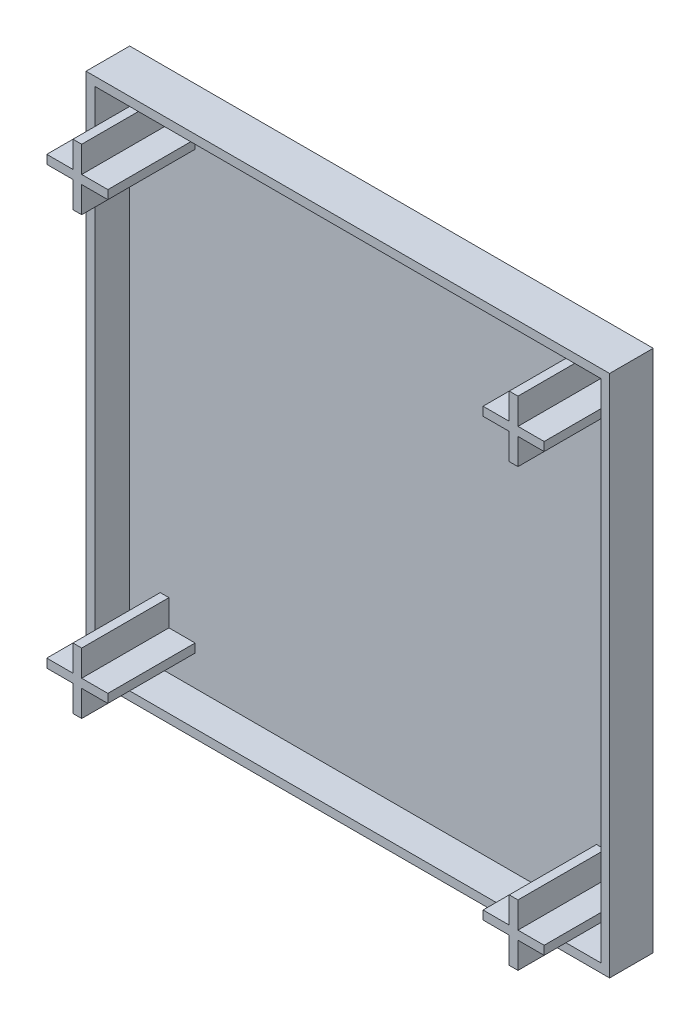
SolidWorks part; units mm, degrees
ref_plane "前视基准面" through (0, 0, 0) normal (0, 0, 1) x (1, 0, 0)
ref_plane "上视基准面" through (0, 0, 0) normal (0, 1, 0) x (1, 0, 0)
ref_plane "右视基准面" through (0, 0, 0) normal (1, 0, 0) x (0, 0, -1)
sketch "草图1" plane through (0, 0, 0) normal (0, 0, 1) x (1, 0, 0)
  line L1 (-30, 30) -> (30, 30)
  line L2 (-30, 30) -> (-30, -30)
  line L3 (-30, -30) -> (30, -30)
  line L4 (30, 30) -> (30, -30)
  dimension "D1" = 60
  dimension "D2" = 60
  dimension "D3" = 30
extrude "凸台-拉伸1" add sketch "草图1" along normal mid plane 5
shell "抽壳1" thickness 1
sketch "草图2" plane through (0, 0, -1.5) normal (0, 0, 1) x (1, 0, 0)
  line L0 (-25, 28.5) -> (-25, 25.5) construction
  line L1 (-28.5, 25.5) -> (-25.5, 25.5)
  line L2 (-28.5, 25.5) -> (-28.5, 24.5)
  line L3 (-28.5, 24.5) -> (-25.5, 24.5)
  line L4 (-21.5, 25.5) -> (-21.5, 24.5)
  line L5 (-25.5, 28.5) -> (-24.5, 28.5)
  line L6 (-25.5, 28.5) -> (-25.5, 25.5)
  line L7 (-25.5, 21.5) -> (-24.5, 21.5)
  line L8 (-24.5, 28.5) -> (-24.5, 25.5)
  line L9 (-25, 21.5) -> (-28.5, 25) construction
  line L10 (24.5, 25.5) -> (21.5, 25.5)
  line L12 (-30, 30) -> (-30, -30) construction
  line L13 (0, 29) -> (0, -29) construction
  line L14 (29, 29) -> (-29, 29) construction
  line L15 (-29, -29) -> (29, -29) construction
  line L16 (28.5, 25) -> (21.5, 25) construction
  line L17 (25, 21.5) -> (28.5, 25) construction
  line L18 (25, 28.5) -> (25, 21.5) construction
  line L19 (24.5, 28.5) -> (24.5, 25.5)
  line L20 (25.5, 21.5) -> (24.5, 21.5)
  line L21 (25.5, 28.5) -> (25.5, 25.5)
  line L22 (25.5, 28.5) -> (24.5, 28.5)
  line L23 (21.5, 25.5) -> (21.5, 24.5)
  line L24 (28.5, 24.5) -> (25.5, 24.5)
  line L25 (28.5, 25.5) -> (28.5, 24.5)
  line L26 (28.5, 25.5) -> (25.5, 25.5)
  line L27 (-29, 0) -> (29, 0) construction
  line L28 (-29, 29) -> (-29, -29) construction
  line L29 (29, -29) -> (29, 29) construction
  line L30 (25, -28.5) -> (25, -21.5) construction
  line L31 (25, -21.5) -> (28.5, -25) construction
  line L32 (28.5, -25) -> (21.5, -25) construction
  line L33 (-28.5, -25) -> (-25.5, -25) construction
  line L34 (-25, -21.5) -> (-28.5, -25) construction
  line L35 (-25, -28.5) -> (-25, -25.5) construction
  line L36 (28.5, -25.5) -> (25.5, -25.5)
  line L37 (28.5, -25.5) -> (28.5, -24.5)
  line L38 (28.5, -24.5) -> (25.5, -24.5)
  line L39 (21.5, -25.5) -> (21.5, -24.5)
  line L40 (25.5, -28.5) -> (24.5, -28.5)
  line L41 (25.5, -28.5) -> (25.5, -25.5)
  line L42 (25.5, -21.5) -> (24.5, -21.5)
  line L43 (24.5, -28.5) -> (24.5, -25.5)
  line L44 (-24.5, -28.5) -> (-24.5, -25.5)
  line L45 (-25.5, -21.5) -> (-24.5, -21.5)
  line L46 (-25.5, -28.5) -> (-25.5, -25.5)
  line L47 (-25.5, -28.5) -> (-24.5, -28.5)
  line L48 (-21.5, -25.5) -> (-21.5, -24.5)
  line L49 (-28.5, -24.5) -> (-25.5, -24.5)
  line L50 (-28.5, -25.5) -> (-28.5, -24.5)
  line L51 (-28.5, -25.5) -> (-25.5, -25.5)
  line L52 (-24.5, 25.5) -> (-21.5, 25.5)
  line L53 (-25.5, 24.5) -> (-25.5, 21.5)
  line L54 (-24.5, 24.5) -> (-21.5, 24.5)
  line L55 (-24.5, 24.5) -> (-24.5, 21.5)
  line L56 (24.5, 24.5) -> (24.5, 21.5)
  line L57 (24.5, 24.5) -> (21.5, 24.5)
  line L58 (25.5, 24.5) -> (25.5, 21.5)
  line L59 (-24.5, -24.5) -> (-21.5, -24.5)
  line L60 (-25.5, -24.5) -> (-25.5, -21.5)
  line L61 (-25, -25) -> (-21.5, -25) construction
  line L62 (-24.5, -25.5) -> (-21.5, -25.5)
  line L63 (-25, -25) -> (-25, -21.5) construction
  line L64 (-24.5, -24.5) -> (-24.5, -21.5)
  line L65 (24.5, -24.5) -> (21.5, -24.5)
  line L66 (24.5, -24.5) -> (24.5, -21.5)
  line L67 (24.5, -25.5) -> (21.5, -25.5)
  line L68 (25.5, -24.5) -> (25.5, -21.5)
  dimension "D1" = 7
  dimension "D2" = 7
  dimension "D3" = 1
  dimension "D4" = 1
  dimension "D5" = 3
  dimension "D6" = 3
  dimension "D8" = 5
extrude "凸台-拉伸2" add sketch "草图2" along normal blind 10
